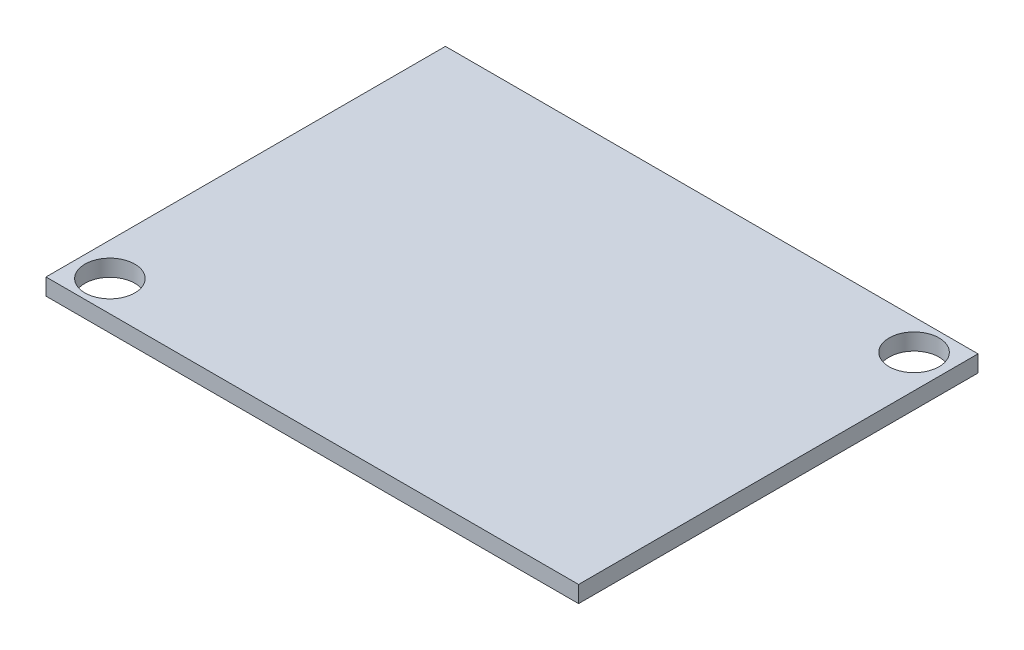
SolidWorks part; units mm, degrees
ref_plane "Front Plane" through (0, 0, 0) normal (0, 0, 1) x (1, 0, 0)
ref_plane "Top Plane" through (0, 0, 0) normal (0, 1, 0) x (1, 0, 0)
ref_plane "Right Plane" through (0, 0, 0) normal (1, 0, 0) x (0, 0, -1)
sketch "Sketch1" plane through (0, 0, 0) normal (0, 1, 0) x (1, 0, 0)
  line L1 (-44.8319, 51.2954) -> (56.7681, 51.2954)
  line L2 (-44.8319, 51.2954) -> (-44.8319, -24.9046)
  line L3 (-44.8319, -24.9046) -> (56.7681, -24.9046)
  line L4 (56.7681, 51.2954) -> (56.7681, -24.9046)
  dimension "D1" = 101.6
  dimension "D2" = 76.2
extrude "Extrude1" add sketch "Sketch1" along normal blind 3.175
sketch "Sketch2" plane through (0, 3.175, 0) normal (0, 1, 0) x (-1, 0, 0)
  line L0 (44.8319, 24.9046) -> (-56.7681, 24.9046) construction
  line L1 (44.8319, -51.2954) -> (44.8319, 24.9046) construction
  line L2 (-56.7681, 24.9046) -> (-56.7681, -51.2954) construction
  line L3 (-56.7681, -51.2954) -> (44.8319, -51.2954) construction
  circle A0 centre (-50.4181, -45.4534) radius 4.7625
  circle A1 centre (38.4819, 19.0626) radius 4.7625
  dimension "D5" = 9.525
  dimension "D6" = 9.525
  dimension "D1" = 5.842
  dimension "D2" = 6.35
  dimension "D3" = 6.35
  dimension "D4" = 5.842
extrude "Cut-Extrude1" cut sketch "Sketch2" against normal blind 3.175
